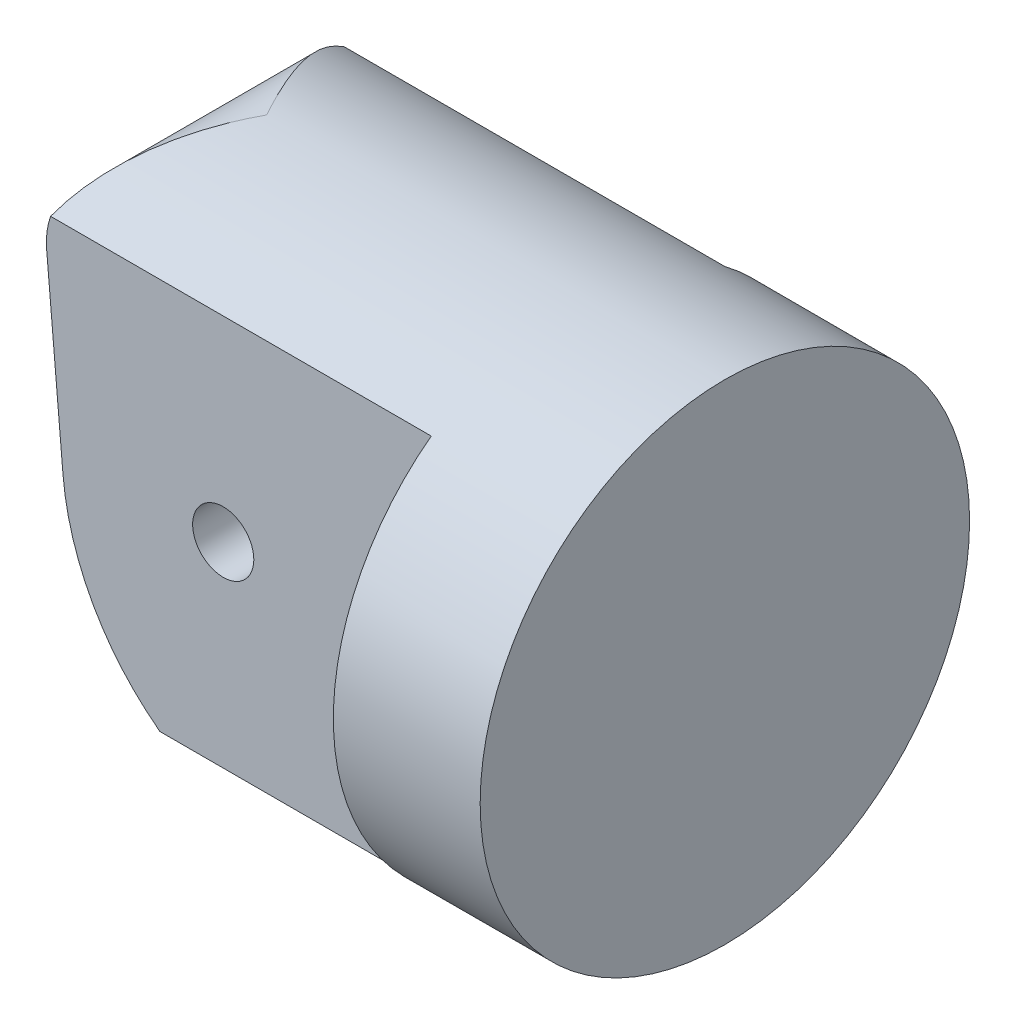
SolidWorks part; units mm, degrees
ref_plane "Plan de face" through (0, 0, 0) normal (0, 0, 1) x (1, 0, 0)
ref_plane "Plan de dessus" through (0, 0, 0) normal (0, 1, 0) x (1, 0, 0)
ref_plane "Plan de droite" through (0, 0, 0) normal (1, 0, 0) x (0, 0, -1)
sketch "Esquisse1" plane through (0, 0, 0) normal (1, 0, 0) x (0, 0, -1)
  circle A0 centre (0, 0) radius 10
  dimension "D1" = 20
extrude "Boss.-Extru.1" add sketch "Esquisse1" against normal blind 22 from offset 4
sketch "Esquisse3" plane through (0, 0, 0) normal (0, 1, 0) x (1, 0, 0)
  line L0 (-26, 0) -> (-26, -6)
  line L2 (0, 0) -> (-26, 0) construction
  line L7 (-26, 10) -> (-26, -10) construction
  line L8 (-26, -10) -> (-4, -10) construction
  line L9 (-26, -10) -> (-10, -10)
  line L10 (-26, -10) -> (-26, -6)
  line L11 (-26, 6) -> (-10, 6)
  line L12 (-10, -10) -> (-10, -6)
  line L13 (-10, 10) -> (-10, 6)
  line L14 (-26, -6) -> (-10, -6)
  line L15 (-26, 10) -> (-26, 6)
  line L16 (-26, 10) -> (-10, 10)
  dimension "D4" = 16
  dimension "D5" = 12
extrude "Enlèv. mat.-Extru.1" cut sketch "Esquisse3" against normal through all and the other way through all contours L10 L9 L12 L14 | L15 L11 L13 L16
sketch "Esquisse4" plane through (0, 0, 0) normal (0, 0, 1) x (1, 0, 0)
  line L0 (0, 0) -> (-26, 0) construction
  line L1 (-26, 8) -> (-26, -8) construction
  circle A0 centre (-18.5, 0) radius 1.25
  dimension "D1" = 2.5
  dimension "D2" = 7.5
extrude "Enlèv. mat.-Extru.2" cut sketch "Esquisse4" against normal through all and the other way through all
sketch "Esquisse5" plane through (0, 0, 0) normal (0, 0, 1) x (1, 0, 0)
  line L0 (-25.7147, 6.7385) -> (-25.0489, -0.8716)
  line L1 (-26, -10) -> (-4, -10) construction
  line L2 (-15.0869, -10) -> (-4, -10)
  line L3 (-4, -10) -> (-4, 10)
  line L4 (-4, 10) -> (-22.7261, 10)
  line L5 (-26, 8) -> (-26, -8) construction
  arc A0 (-15.0869, -10) -> (-25.0489, -0.8716) centre (-15.0869, 0) cw
  arc A1 (-22.7261, 10) -> (-25.7147, 6.7385) centre (-22.7261, 7) ccw
  point P13 (-24.2502, -10)
  point P16 (-26, 10)
  dimension "D2" = 10
  dimension "D3" = 3
  dimension "D1" = 5
extrude "Enlèv. mat.-Extru.3" cut sketch "Esquisse5" against normal through all and the other way through all flip side to cut
sketch "Esquisse10" plane through (-24.9343, -2.1815, 0) normal (-0.9962, -0.0872, 0) x (0, 0, 1)
  line L1 (-3, 8.9541) -> (3, 8.9541)
  line L2 (-3, 8.9541) -> (-3, -5.0459)
  line L3 (-3, -5.0459) -> (3, -5.0459)
  line L4 (3, 8.9541) -> (3, -5.0459)
  line L5 (-6, 8.9541) -> (-6, 1.3149) construction
  line L6 (6, 8.9541) -> (6, 1.3149) construction
  point P10 (0, 8.9541)
  dimension "D1" = 3
  dimension "D2" = 3
  dimension "D3" = 14
extrude "Enlèv. mat.-Extru.6" cut sketch "Esquisse10" against normal blind 12
sketch "Esquisse12" plane through (0, 0, 0) normal (0, 0, 1) x (1, 0, 0)
  line L0 (-15.0869, -10) -> (16.6078, -10) construction
  line L1 (-2, -2.2122) -> (-2, -16.7173) construction
  point P6 (-2, -9)
  dimension "D1" = 2
  dimension "D2" = 9
